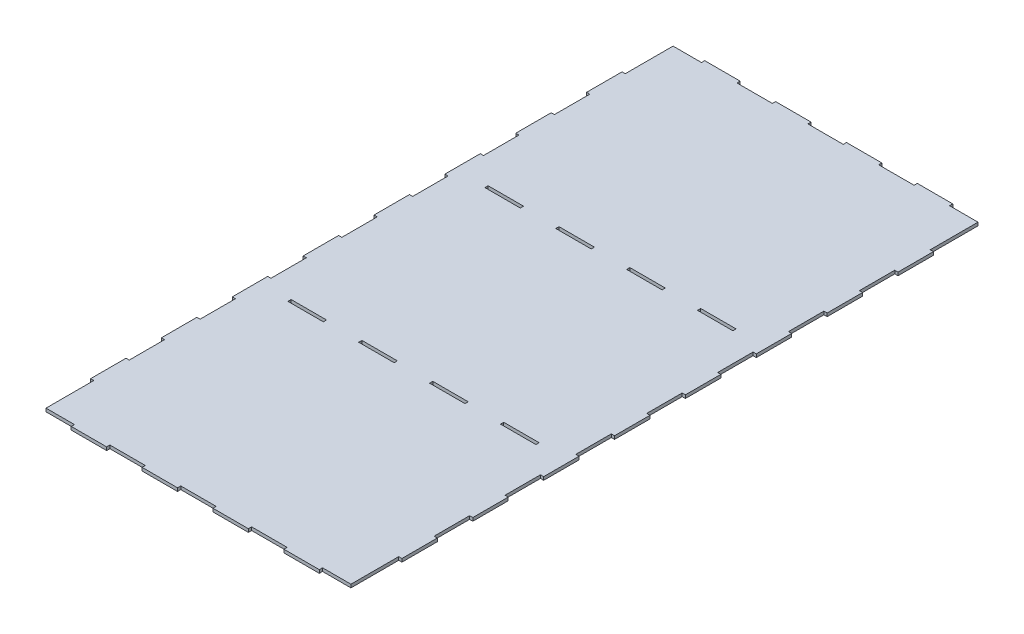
SolidWorks part; units mm, degrees
ref_plane "Front Plane" through (0, 0, 0) normal (0, 0, 1) x (1, 0, 0)
ref_plane "Top Plane" through (0, 0, 0) normal (0, 1, 0) x (1, 0, 0)
ref_plane "Right Plane" through (0, 0, 0) normal (1, 0, 0) x (0, 0, -1)
sketch "Sketch1" plane through (0, 0, 0) normal (0, 1, 0) x (1, 0, 0)
  line L0 (889, 590) -> (889, 545.5)
  line L1 (889, 545.5) -> (886, 545.5)
  line L2 (886, 545.5) -> (886, 512.5)
  line L3 (886, 512.5) -> (889, 512.5)
  line L4 (889, 512.5) -> (889, 479.5)
  line L5 (889, 479.5) -> (886, 479.5)
  line L6 (886, 479.5) -> (886, 446.5)
  line L7 (886, 446.5) -> (889, 446.5)
  line L8 (889, 446.5) -> (889, 413.5)
  line L9 (889, 413.5) -> (886, 413.5)
  line L10 (886, 413.5) -> (886, 380.5)
  line L11 (886, 380.5) -> (889, 380.5)
  line L12 (889, 380.5) -> (889, 347.5)
  line L13 (889, 347.5) -> (886, 347.5)
  line L14 (886, 347.5) -> (886, 314.5)
  line L15 (886, 314.5) -> (889, 314.5)
  line L16 (889, 314.5) -> (889, 281.5)
  line L17 (889, 281.5) -> (886, 281.5)
  line L18 (886, 281.5) -> (886, 248.5)
  line L19 (886, 248.5) -> (889, 248.5)
  line L20 (889, 248.5) -> (889, 215.5)
  line L21 (889, 215.5) -> (886, 215.5)
  line L22 (886, 215.5) -> (886, 182.5)
  line L23 (886, 182.5) -> (889, 182.5)
  line L24 (889, 182.5) -> (889, 149.5)
  line L25 (889, 149.5) -> (886, 149.5)
  line L26 (886, 149.5) -> (886, 116.5)
  line L27 (886, 116.5) -> (889, 116.5)
  line L28 (889, 116.5) -> (889, 83.5)
  line L29 (889, 83.5) -> (886, 83.5)
  line L30 (886, 83.5) -> (886, 50.5)
  line L31 (886, 50.5) -> (889, 50.5)
  line L32 (889, 50.5) -> (889, 17.5)
  line L33 (889, 17.5) -> (889, 6)
  line L34 (889, 6) -> (915.5, 6)
  line L35 (915.5, 6) -> (915.5, 3)
  line L36 (915.5, 3) -> (948.5, 3)
  line L37 (948.5, 3) -> (948.5, 6)
  line L38 (948.5, 6) -> (981.5, 6)
  line L39 (981.5, 6) -> (981.5, 3)
  line L40 (981.5, 3) -> (1014.5, 3)
  line L41 (1014.5, 3) -> (1014.5, 6)
  line L42 (1014.5, 6) -> (1047.5, 6)
  line L43 (1047.5, 6) -> (1047.5, 3)
  line L44 (1047.5, 3) -> (1080.5, 3)
  line L45 (1080.5, 3) -> (1080.5, 6)
  line L46 (1080.5, 6) -> (1113.5, 6)
  line L47 (1113.5, 6) -> (1113.5, 3)
  line L48 (1113.5, 3) -> (1146.5, 3)
  line L49 (1146.5, 3) -> (1146.5, 6)
  line L50 (1146.5, 6) -> (1173, 6)
  line L51 (1173, 6) -> (1173, 50.5)
  line L52 (1173, 50.5) -> (1176, 50.5)
  line L53 (1176, 50.5) -> (1176, 83.5)
  line L54 (1176, 83.5) -> (1173, 83.5)
  line L55 (1173, 83.5) -> (1173, 116.5)
  line L56 (1173, 116.5) -> (1176, 116.5)
  line L57 (1176, 116.5) -> (1176, 149.5)
  line L58 (1176, 149.5) -> (1173, 149.5)
  line L59 (1173, 149.5) -> (1173, 182.5)
  line L60 (1173, 182.5) -> (1176, 182.5)
  line L61 (1176, 182.5) -> (1176, 215.5)
  line L62 (1176, 215.5) -> (1173, 215.5)
  line L63 (1173, 215.5) -> (1173, 248.5)
  line L64 (1173, 248.5) -> (1176, 248.5)
  line L65 (1176, 248.5) -> (1176, 281.5)
  line L66 (1176, 281.5) -> (1173, 281.5)
  line L67 (1173, 281.5) -> (1173, 314.5)
  line L68 (1173, 314.5) -> (1176, 314.5)
  line L69 (1176, 314.5) -> (1176, 347.5)
  line L70 (1176, 347.5) -> (1173, 347.5)
  line L71 (1173, 347.5) -> (1173, 380.5)
  line L72 (1173, 380.5) -> (1176, 380.5)
  line L73 (1176, 380.5) -> (1176, 413.5)
  line L74 (1176, 413.5) -> (1173, 413.5)
  line L75 (1173, 413.5) -> (1173, 446.5)
  line L76 (1173, 446.5) -> (1176, 446.5)
  line L77 (1176, 446.5) -> (1176, 479.5)
  line L78 (1176, 479.5) -> (1173, 479.5)
  line L79 (1173, 479.5) -> (1173, 512.5)
  line L80 (1173, 512.5) -> (1176, 512.5)
  line L81 (1176, 512.5) -> (1176, 545.5)
  line L82 (1176, 545.5) -> (1173, 545.5)
  line L83 (1173, 545.5) -> (1173, 578.5)
  line L84 (1173, 578.5) -> (1173, 590)
  line L85 (1173, 590) -> (1146.5, 590)
  line L86 (1146.5, 590) -> (1146.5, 593)
  line L87 (1146.5, 593) -> (1113.5, 593)
  line L88 (1113.5, 593) -> (1113.5, 590)
  line L89 (1113.5, 590) -> (1080.5, 590)
  line L90 (1080.5, 590) -> (1080.5, 593)
  line L91 (1080.5, 593) -> (1047.5, 593)
  line L92 (1047.5, 593) -> (1047.5, 590)
  line L93 (1047.5, 590) -> (1014.5, 590)
  line L94 (1014.5, 590) -> (1014.5, 593)
  line L95 (1014.5, 593) -> (981.5, 593)
  line L96 (981.5, 593) -> (981.5, 590)
  line L97 (981.5, 590) -> (948.5, 590)
  line L98 (948.5, 590) -> (948.5, 593)
  line L99 (948.5, 593) -> (915.5, 593)
  line L100 (915.5, 593) -> (915.5, 590)
  line L101 (915.5, 590) -> (889, 590)
  line L102 (915.5, 207.75) -> (948.5, 207.75)
  line L127 (915.5, 391.25) -> (948.5, 391.25)
  line L128 (915.5, 391.25) -> (915.5, 388.25)
  line L129 (915.5, 388.25) -> (948.5, 388.25)
  line L130 (948.5, 391.25) -> (948.5, 388.25)
  line L131 (981.5, 391.25) -> (1014.5, 391.25)
  line L132 (981.5, 391.25) -> (981.5, 388.25)
  line L133 (981.5, 388.25) -> (1014.5, 388.25)
  line L134 (1014.5, 391.25) -> (1014.5, 388.25)
  line L135 (1047.5, 391.25) -> (1080.5, 391.25)
  line L136 (1047.5, 391.25) -> (1047.5, 388.25)
  line L137 (1047.5, 388.25) -> (1080.5, 388.25)
  line L138 (1080.5, 391.25) -> (1080.5, 388.25)
  line L139 (1113.5, 391.25) -> (1146.5, 391.25)
  line L140 (1113.5, 391.25) -> (1113.5, 388.25)
  line L141 (1113.5, 388.25) -> (1146.5, 388.25)
  line L142 (1146.5, 391.25) -> (1146.5, 388.25)
  line L143 (915.5, 207.75) -> (915.5, 204.75)
  line L144 (915.5, 204.75) -> (948.5, 204.75)
  line L145 (948.5, 207.75) -> (948.5, 204.75)
  line L146 (981.5, 207.75) -> (1014.5, 207.75)
  line L147 (981.5, 207.75) -> (981.5, 204.75)
  line L148 (981.5, 204.75) -> (1014.5, 204.75)
  line L149 (1014.5, 207.75) -> (1014.5, 204.75)
  line L150 (1047.5, 207.75) -> (1080.5, 207.75)
  line L151 (1047.5, 207.75) -> (1047.5, 204.75)
  line L152 (1047.5, 204.75) -> (1080.5, 204.75)
  line L153 (1080.5, 207.75) -> (1080.5, 204.75)
  line L154 (1113.5, 207.75) -> (1146.5, 207.75)
  line L155 (1113.5, 207.75) -> (1113.5, 204.75)
  line L156 (1113.5, 204.75) -> (1146.5, 204.75)
  line L157 (1146.5, 207.75) -> (1146.5, 204.75)
  point P0 (1064, 391.25)
  dimension "D19" = 198.75
  dimension "D22" = 198.75
  dimension "D1" = 886
  dimension "D2" = 889
  dimension "D3" = 915.5
  dimension "D4" = 948.5
  dimension "D5" = 3
  dimension "D6" = 17.5
  dimension "D8" = 198.75
  dimension "D9" = 198.75
  dimension "D10" = 198.75
  dimension "D11" = 198.75
  dimension "D12" = 33
  dimension "D13" = 33
  dimension "D14" = 33
  dimension "D15" = 33
  dimension "D16" = 33
  dimension "D17" = 33
  dimension "D18" = 33
  dimension "D20" = 198.75
  dimension "D21" = 198.75
  dimension "D40" = 3
  dimension "D41" = 3
  dimension "D42" = 3
  dimension "D49" = 33
  dimension "D55" = 26.5
  dimension "D56" = 33
  dimension "D57" = 33
  dimension "D58" = 33
  dimension "D59" = 33
  dimension "D60" = 33
  dimension "D61" = 33
  dimension "D62" = 3
  dimension "D63" = 3
  dimension "D64" = 3
  dimension "D65" = 3
  dimension "D66" = 26.5
  dimension "D71" = 33
extrude "Boss-Extrude1" add sketch "Sketch1" along normal blind 3
